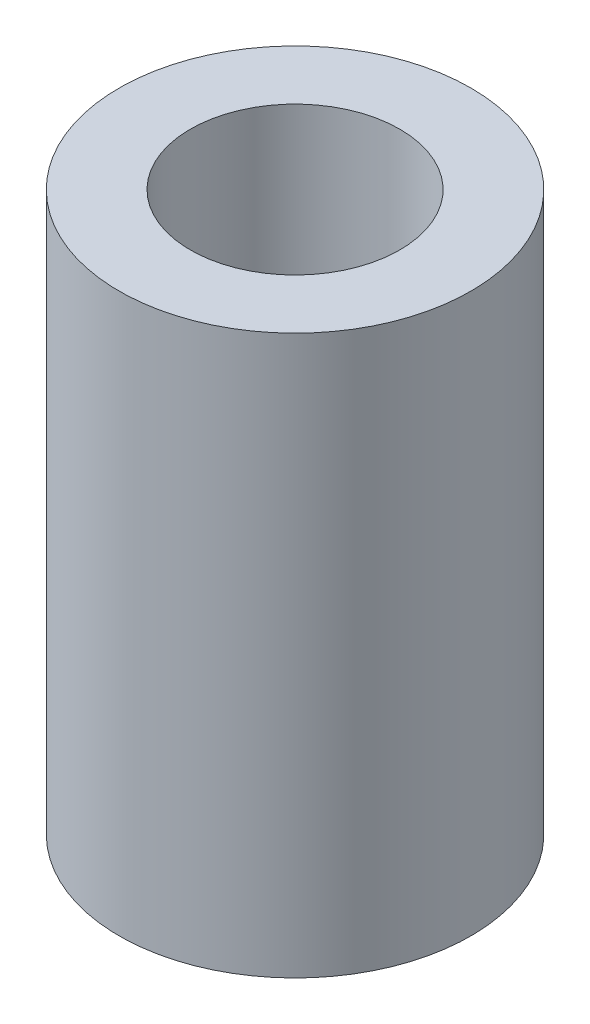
SolidWorks part; units mm, degrees
ref_plane "Front Plane" through (0, 0, 0) normal (0, 0, 1) x (1, 0, 0)
ref_plane "Top Plane" through (0, 0, 0) normal (0, 1, 0) x (1, 0, 0)
ref_plane "Right Plane" through (0, 0, 0) normal (1, 0, 0) x (0, 0, -1)
sketch "Sketch1" plane through (0, 0, 0) normal (0, 0, 1) x (1, 0, 0)
  line L0 (0, 0) -> (0, 38.1) construction
  line L2 (2.3813, 0) -> (4.0005, 0)
  line L3 (2.3813, 0) -> (2.3813, 12.7)
  line L4 (2.3813, 12.7) -> (4.0005, 12.7)
  line L5 (4.0005, 0) -> (4.0005, 12.7)
  dimension "D1" = 25.4
  dimension "D2" = 8.001
  dimension "D3" = 4.7625
  dimension "D4" = 12.7
revolve "Revolve1" add sketch "Sketch1" angle 360 about L0
